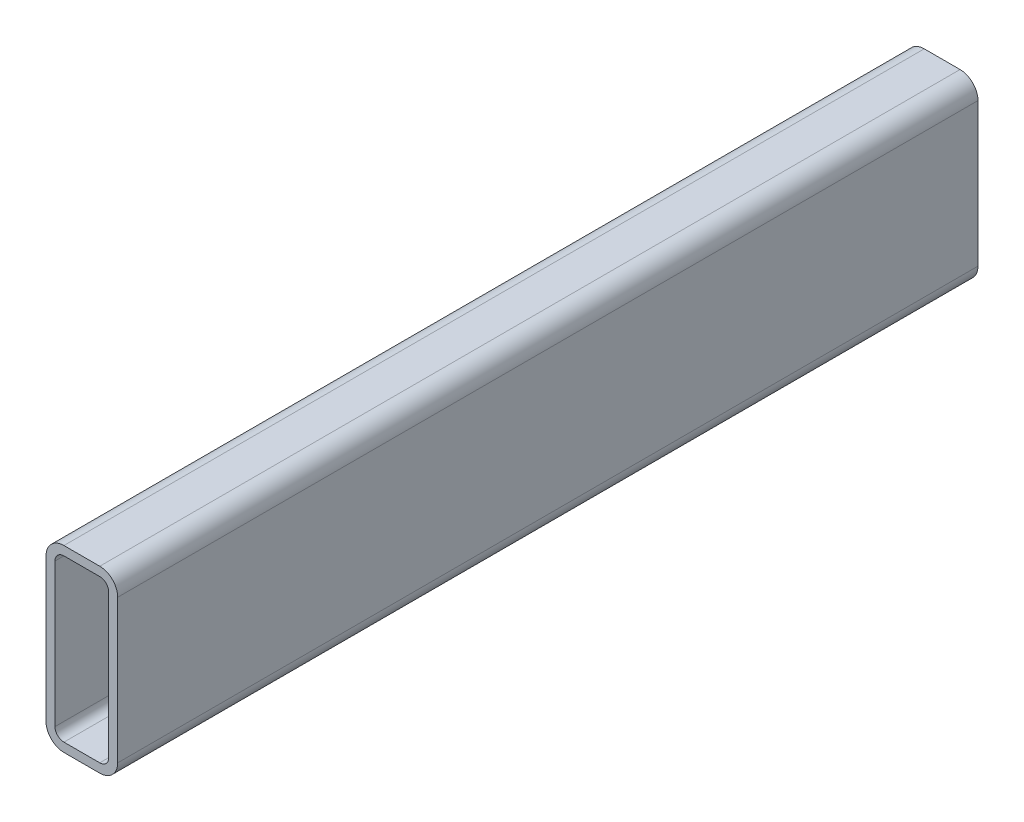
SolidWorks part; units mm, degrees
ref_plane "Front Plane" through (0, 0, 0) normal (0, 0, 1) x (1, 0, 0)
ref_plane "Top Plane" through (0, 0, 0) normal (0, 1, 0) x (1, 0, 0)
ref_plane "Right Plane" through (0, 0, 0) normal (1, 0, 0) x (0, 0, -1)
sketch "Sketch1" plane through (0, 0, 0) normal (0, 0, 1) x (1, 0, 0)
  line B0 (25.4, 57.15) -> (25.4, 6.35)
  line B1 (6.35, 63.5) -> (19.05, 63.5)
  arc B2 (25.4, 57.15) -> (19.05, 63.5) centre (19.05, 57.15) ccw
  arc B3 (19.05, 0) -> (25.4, 6.35) centre (19.05, 6.35) ccw
  line B4 (19.05, 0) -> (6.35, 0)
  arc B5 (0, 6.35) -> (6.35, 0) centre (6.35, 6.35) ccw
  line B6 (0, 6.35) -> (0, 57.15)
  arc B7 (6.35, 63.5) -> (0, 57.15) centre (6.35, 57.15) ccw
  line B8 (6.35, 60.325) -> (19.05, 60.325)
  arc B9 (22.225, 57.15) -> (19.05, 60.325) centre (19.05, 57.15) ccw
  line B10 (22.225, 57.15) -> (22.225, 6.35)
  arc B11 (19.05, 3.175) -> (22.225, 6.35) centre (19.05, 6.35) ccw
  line B12 (19.05, 3.175) -> (6.35, 3.175)
  arc B13 (3.175, 6.35) -> (6.35, 3.175) centre (6.35, 6.35) ccw
  line B14 (3.175, 6.35) -> (3.175, 57.15)
  arc B15 (6.35, 60.325) -> (3.175, 57.15) centre (6.35, 57.15) ccw
sketch_block_instance "HSS2.5x1x0.125-1"
sketch_block "HSS2.5x1x0.125"
extrude "Boss-Extrude1" add sketch "Sketch1" along normal blind 304.8
